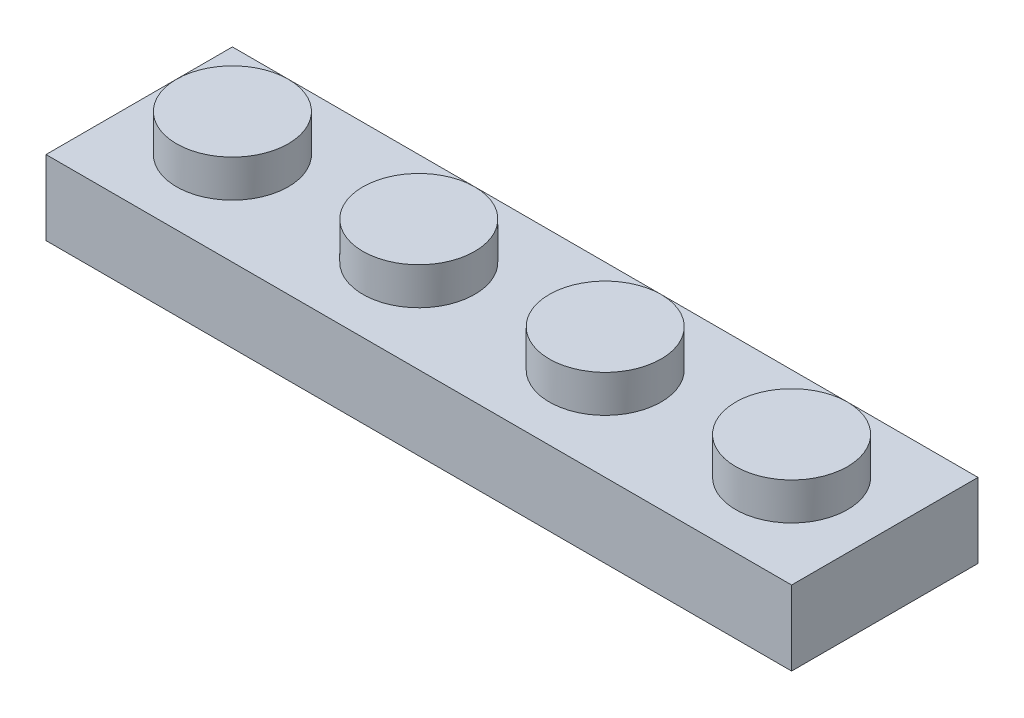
SolidWorks part; units mm, degrees
ref_plane "Front Plane" through (0, 0, 0) normal (0, 0, 1) x (1, 0, 0)
ref_plane "Top Plane" through (0, 0, 0) normal (0, 1, 0) x (1, 0, 0)
ref_plane "Right Plane" through (0, 0, 0) normal (1, 0, 0) x (0, 0, -1)
sketch "Sketch1" plane through (0, 0, 0) normal (0, 1, 0) x (1, 0, 0)
  line L5 (-16, -4) -> (16, -4)
  line L6 (-16, -4) -> (-16, 4)
  line L7 (-16, 4) -> (16, 4)
  line L8 (16, -4) -> (16, 4)
  line L9 (-16, -4) -> (16, 4) construction
  line L10 (-16, 4) -> (16, -4) construction
  point P0 (0, 0)
  dimension "D1" = 8
  dimension "D2" = 32
extrude "Boss-Extrude1" add sketch "Sketch1" along normal blind 3.2
sketch "Sketch2" plane through (0, 3.2, 0) normal (0, 1, 0) x (1, 0, 0)
  line L0 (-16, 4) -> (-16, -4) construction
  circle A2 centre (-12, 0) radius 2.4
  circle A6 centre (-4, 0) radius 2.4
  circle A7 centre (4, 0) radius 2.4
  circle A8 centre (12, 0) radius 2.4
  dimension "D1" = 4.8
  dimension "D2" = 4
extrude "Boss-Extrude2" add sketch "Sketch2" along normal blind 1.6
shell "Shell1" thickness 1.6
sketch "Sketch11" plane through (0, 1.6, 0) normal (0, -1, 0) x (-1, 0, 0)
  line L0 (16, 4) -> (16, -4) construction
  line L2 (-16, 4) -> (16, 4) construction
  circle A0 centre (8, 0) radius 1.77
  dimension "D1" = 3.54
  dimension "D2" = 8
  dimension "D3" = 4
extrude "Boss-Extrude11" add sketch "Sketch11" along normal up to surface (1.6 mm away)
pattern_linear "LPattern4" count 3 spacing 8 along (1, 0, 0) of "Boss-Extrude11"
